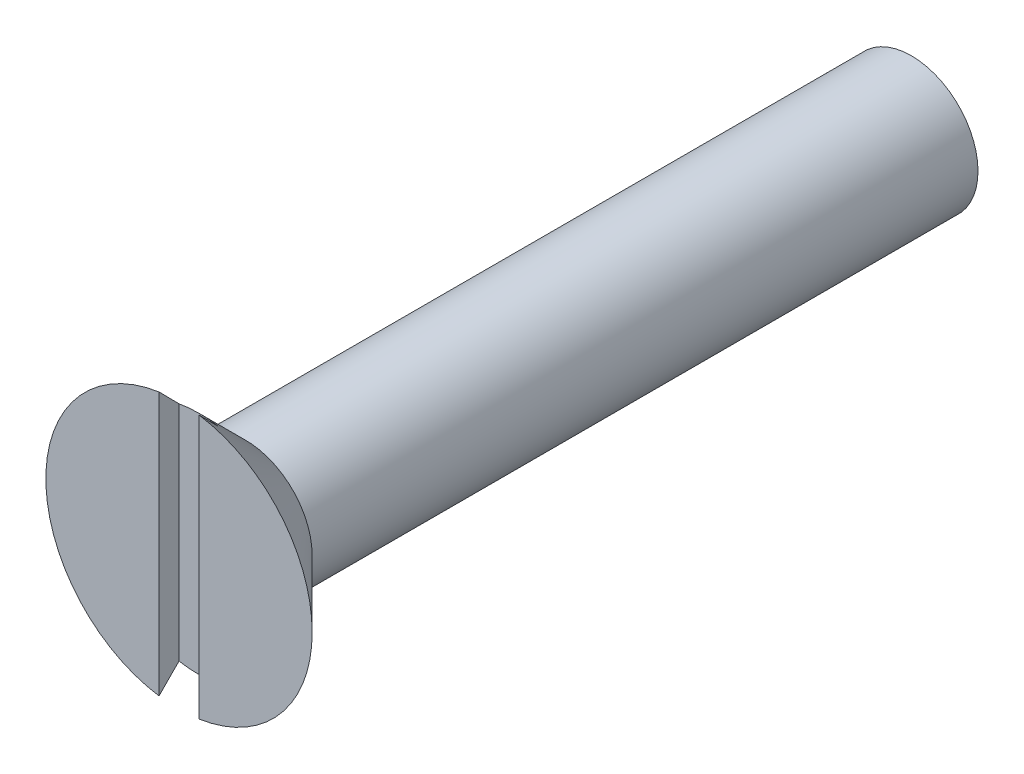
SolidWorks part; units mm, degrees
ref_plane "Front Plane" through (0, 0, 0) normal (0, 0, 1) x (1, 0, 0)
ref_plane "Top Plane" through (0, 0, 0) normal (0, 1, 0) x (1, 0, 0)
ref_plane "Right Plane" through (0, 0, 0) normal (1, 0, 0) x (0, 0, -1)
sketch "Sketch1" plane through (0, 0, 0) normal (0, 0, 1) x (1, 0, 0)
  circle A0 centre (0, 0) radius 2
extrude "Extrude2" add sketch "Sketch1" against normal blind 1
chamfer "Chamfer1" distance 1 angle 45 1 edges at (2, 0, -1)
sketch "Sketch2" plane through (0, 0, -1) normal (0, 0, -1) x (-1, 0, 0)
  circle A0 centre (0, 0) radius 1
extrude "Extrude3" add sketch "Sketch2" along normal blind 10
sketch "Sketch3" plane through (0, 0, 0) normal (0, 0, 1) x (1, 0, 0)
  line L3 (-0.3, 1.9774) -> (-0.3, -1.9774)
  line L4 (0.3, 1.9774) -> (0.3, -1.9774)
  circle A0 centre (0, 0) radius 2 construction
extrude "Cut-Extrude1" cut sketch "Sketch3" against normal blind 0.3
